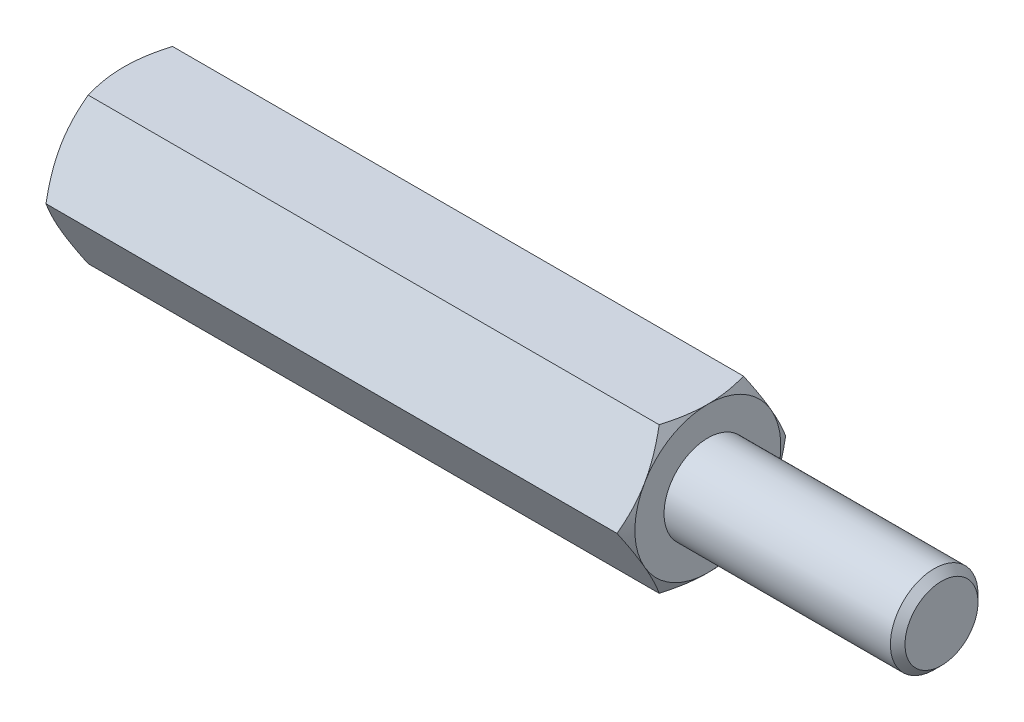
SolidWorks part; units mm, degrees
ref_plane "Front Plane" through (0, 0, 0) normal (0, 0, 1) x (1, 0, 0)
ref_plane "Top Plane" through (0, 0, 0) normal (0, 1, 0) x (1, 0, 0)
ref_plane "Right Plane" through (0, 0, 0) normal (1, 0, 0) x (0, 0, -1)
sketch "Sketch1" plane through (0, 0, 0) normal (1, 0, 0) x (0, 0, -1)
  line L1 (1.4434, 2.5) -> (-1.4434, 2.5)
  line L2 (-1.4434, 2.5) -> (-2.8868, 0)
  line L3 (-2.8868, 0) -> (-1.4434, -2.5)
  line L4 (-1.4434, -2.5) -> (1.4434, -2.5)
  line L5 (1.4434, -2.5) -> (2.8868, 0)
  line L6 (2.8868, 0) -> (1.4434, 2.5)
  circle A0 centre (0, 0) radius 2.5 construction
  dimension "D1" = 5
extrude "Extrude2" add sketch "Sketch1" along normal mid plane 20
sketch "Sketch2" plane through (0, 0, 0) normal (0, 0, 1) x (1, 0, 0)
  line L0 (-10, 2.5) -> (-8.5, 5.0981)
  line L1 (-10, 5.5) -> (-10, 2.5)
  line L3 (0, 0) -> (50000, 0) construction
  arc A0 (-8.5, 5.0981) -> (-10, 5.5) centre (-9.1962, 5.5) ccw
  dimension "D1" = 30
  dimension "D2" = 3
revolve "Cut-Revolve1" cut sketch "Sketch2" angle 360 about L3
mirror "Mirror1" about plane through (0, 0, 0) normal (1, 0, 0) of "Cut-Revolve1"
sketch "Sketch3" plane through (-10, 0, 0) normal (-1, 0, 0) x (0, 0, 1)
  circle A0 centre (0, 0) radius 1.25
  dimension "D1" = 2.5
extrude "Extrude3" cut sketch "Sketch3" against normal blind 8
sketch "Sketch4" plane through (0, 0, 0) normal (0, 0, 1) x (1, 0, 0)
  line L0 (-2, 0) -> (-2, 1.25)
  line L1 (9.7767, 0) -> (-9.7767, 0) construction
  line L2 (-2, 1.25) -> (-1.2783, 0)
  line L3 (-1.2783, 0) -> (-2, 0)
  line L4 (-10, 1.25) -> (-10, -1.25) construction
  point P4 (-10, 0)
  dimension "D1" = 30
  dimension "D2" = 1.25
  dimension "D3" = 8
revolve "Cut-Revolve2" cut sketch "Sketch4" angle 360 about L3
sketch "Sketch5" plane through (10, 0, 0) normal (1, 0, 0) x (0, 0, -1)
  circle A0 centre (0, 0) radius 1.5
  dimension "D1" = 3
extrude "Extrude4" add sketch "Sketch5" along normal blind 8
chamfer "Chamfer1" distance 0.25 angle 45 1 edges at (18, 0, -1.5)
equation "\"D2@Sketch4\" = \"D1@Sketch3\"/2"
